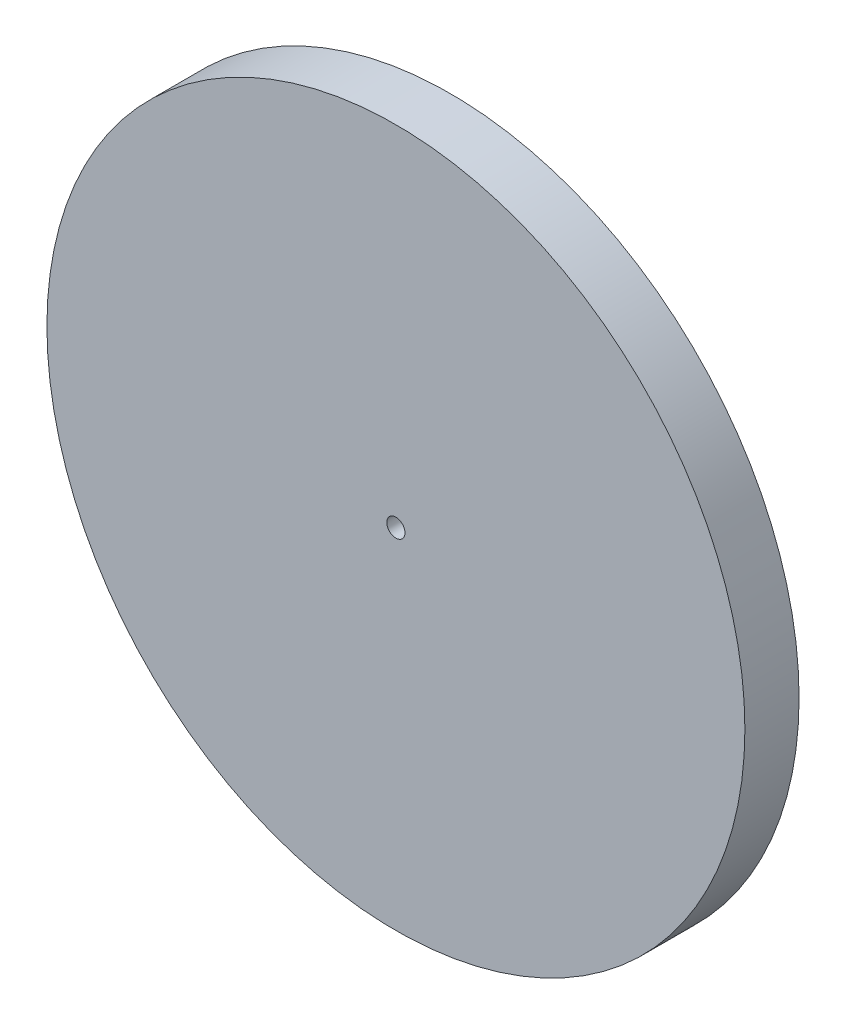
SolidWorks part; units mm, degrees
ref_plane "front" through (0, 0, 0) normal (0, 0, 1) x (1, 0, 0)
ref_plane "top" through (0, 0, 0) normal (0, 1, 0) x (1, 0, 0)
ref_plane "right" through (0, 0, 0) normal (1, 0, 0) x (0, 0, -1)
sketch "Sketch1" plane through (0, 0, 0) normal (0, 0, 1) x (1, 0, 0)
  circle A0 centre (0, 0) radius 152.146
  dimension "D1" = 304.292
extrude "Base-Extrude" add sketch "Sketch1" against normal blind 23.622
sketch "Sketch2" plane through (0, 0, 0) normal (0, 0, 1) x (1, 0, 0)
  circle A0 centre (0, 0) radius 3.9624
  dimension "D1" = 7.9248
extrude "Cut-Extrude1" cut sketch "Sketch2" against normal through all
